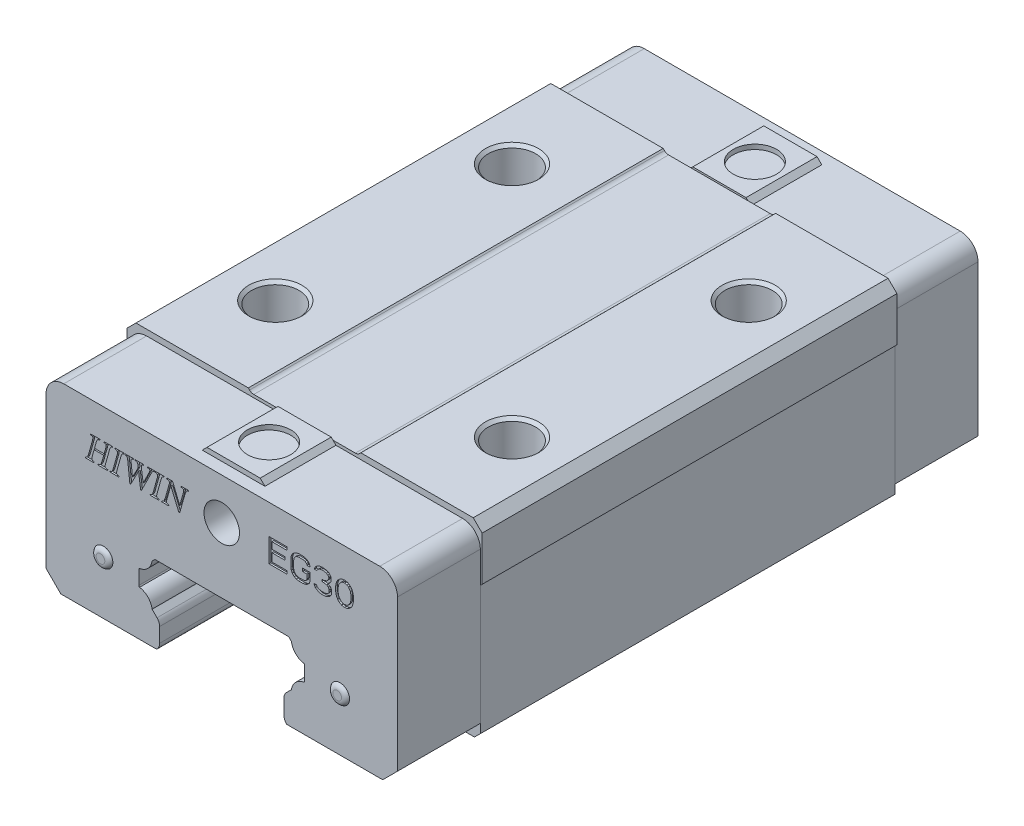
SolidWorks part; units mm, degrees
ref_plane "前视基准面" through (0, 0, 0) normal (0, 0, 1) x (1, 0, 0)
ref_plane "上视基准面" through (0, 0, 0) normal (0, 1, 0) x (1, 0, 0)
ref_plane "右视基准面" through (0, 0, 0) normal (1, 0, 0) x (0, 0, -1)
imported_body "输入1"
sketch "草图1" plane through (0, 0, 14) normal (0, 0, 1) x (1, 0, 0)
  line L0 (0, 0) -> (0, -23) construction
  line L1 (-28.5, 19) -> (-9.5, 19) construction
  line L23 (-14, -2.848) -> (-14, -5.152)
  line L24 (11.7582, -0.4582) -> (11.3, 0)
  line L25 (-11.3, 0) -> (-11.7582, -0.4582)
  line L26 (-10.5, -9.4213) -> (-10.5, -11.8787)
  line L27 (14, -5.152) -> (14, -2.848)
  line L28 (-10.9393, -12.9393) -> (-13.5607, -15.5607)
  line L29 (-12.5, -23) -> (-5, -23)
  line L30 (-5, -23) -> (-4.5, -22.5)
  line L31 (10.5, -11.8787) -> (10.5, -9.4213)
  line L32 (10.9393, -8.3607) -> (11.7582, -7.5418)
  line L33 (12.5, -23) -> (14, -21.5)
  line L34 (13.5607, -15.5607) -> (10.9393, -12.9393)
  line L35 (11.3, 0) -> (-11.3, 0)
  line L36 (-5, -23) -> (5, -23) construction
  line L37 (-4.5, -22.5) -> (4.5, -22.5)
  line L38 (14, -21.5) -> (14, -16.6213)
  line L39 (-14, -21.5) -> (-12.5, -23)
  line L40 (4.5, -22.5) -> (5, -23)
  line L41 (-11.7582, -7.5418) -> (-10.9393, -8.3607)
  line L42 (-14, -16.6213) -> (-14, -21.5)
  line L43 (5, -23) -> (12.5, -23)
  arc A18 (-13.8926, -2.618) -> (-14, -2.848) centre (-13.7, -2.848) ccw
  arc A19 (-11.7782, -7.5198) -> (-11.7582, -7.5418) centre (-11.5461, -7.3297) ccw
  arc A20 (-10.9393, -12.9393) -> (-10.5, -11.8787) centre (-12, -11.8787) ccw
  arc A21 (10.5, -11.8787) -> (10.9393, -12.9393) centre (12, -11.8787) ccw
  arc A22 (13.8926, -5.382) -> (14, -5.152) centre (13.7, -5.152) ccw
  arc A23 (14, -2.848) -> (13.8926, -2.618) centre (13.7, -2.848) ccw
  arc A24 (13.8926, -5.382) -> (11.7782, -7.5198) centre (14.2555, -7.8555) ccw
  arc A25 (11.7782, -0.4802) -> (13.8926, -2.618) centre (14.2555, -0.1445) ccw
  arc A26 (-13.5607, -15.5607) -> (-14, -16.6213) centre (-12.5, -16.6213) ccw
  arc A27 (14, -16.6213) -> (13.5607, -15.5607) centre (12.5, -16.6213) ccw
  arc A28 (-10.5, -9.4213) -> (-10.9393, -8.3607) centre (-12, -9.4213) ccw
  arc A29 (-13.8926, -2.618) -> (-11.7782, -0.4802) centre (-14.2555, -0.1445) ccw
  arc A30 (-11.7782, -7.5198) -> (-13.8926, -5.382) centre (-14.2555, -7.8555) ccw
  arc A31 (11.7582, -7.5418) -> (11.7782, -7.5198) centre (11.5461, -7.3297) ccw
  arc A32 (-14, -5.152) -> (-13.8926, -5.382) centre (-13.7, -5.152) ccw
  arc A33 (10.9393, -8.3607) -> (10.5, -9.4213) centre (12, -9.4213) ccw
  arc A34 (11.7782, -0.4802) -> (11.7582, -0.4582) centre (11.5461, -0.6703) ccw
  arc A35 (-11.7582, -0.4582) -> (-11.7782, -0.4802) centre (-11.5461, -0.6703) ccw
  dimension "D1" = 42
extrude "切除-拉伸1" cut sketch "草图1" against normal through all
sketch "草图2" plane through (0, 0, 0) normal (0, 0, 1) x (1, 0, 0)
  line L0 (30, 10) -> (29.7, 9.7) construction
  line L1 (29.7, -12) -> (29.71, -12)
  line L2 (29.7, -12) -> (29.7, 9.71)
  line L3 (29.7, 9.71) -> (29.71, 9.71)
  line L4 (29.71, -12) -> (29.71, 9.71)
  dimension "D1" = 0.01
extrude "凸台-拉伸1" add sketch "草图2" against normal up to surface (70.1 mm away)
